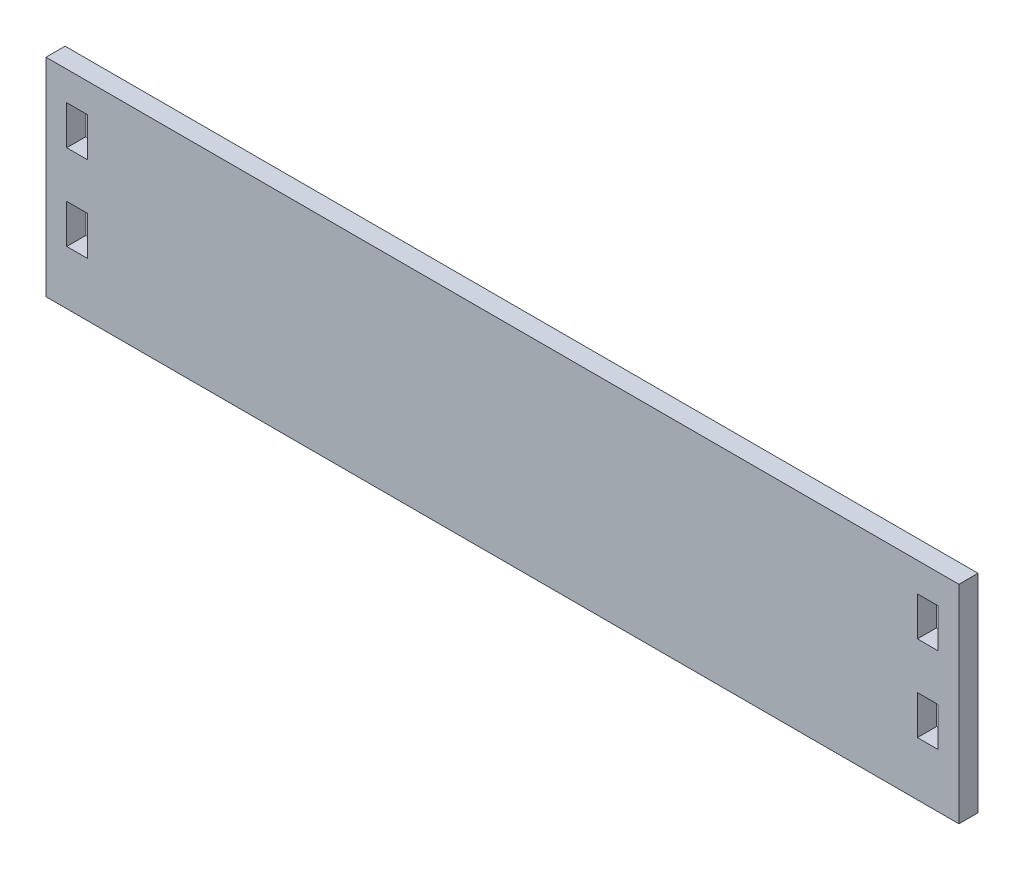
SolidWorks part; units mm, degrees
ref_plane "Front Plane" through (0, 0, 0) normal (0, 0, 1) x (1, 0, 0)
ref_plane "Top Plane" through (0, 0, 0) normal (0, 1, 0) x (1, 0, 0)
ref_plane "Right Plane" through (0, 0, 0) normal (1, 0, 0) x (0, 0, -1)
sketch "Sketch1" plane through (0, 0, 0) normal (0, 0, 1) x (1, 0, 0)
  line L0 (139.7, 63.5) -> (139.7, 0) construction
  line L1 (0, 0) -> (279.4, 0)
  line L2 (0, 0) -> (0, 63.5)
  line L3 (0, 63.5) -> (279.4, 63.5)
  line L4 (279.4, 0) -> (279.4, 63.5)
  line L5 (6.35, 28.448) -> (12.7, 28.448)
  line L6 (6.35, 28.448) -> (6.35, 16.51)
  line L7 (6.35, 16.51) -> (12.7, 16.51)
  line L8 (12.7, 28.448) -> (12.7, 16.51)
  line L9 (6.35, 54.61) -> (12.7, 54.61)
  line L10 (6.35, 54.61) -> (6.35, 42.672)
  line L11 (6.35, 42.672) -> (12.7, 42.672)
  line L12 (12.7, 54.61) -> (12.7, 42.672)
  line L13 (266.7, 54.61) -> (266.7, 42.672)
  line L14 (273.05, 42.672) -> (266.7, 42.672)
  line L15 (273.05, 54.61) -> (273.05, 42.672)
  line L16 (273.05, 54.61) -> (266.7, 54.61)
  line L17 (266.7, 28.448) -> (266.7, 16.51)
  line L18 (273.05, 16.51) -> (266.7, 16.51)
  line L19 (273.05, 28.448) -> (273.05, 16.51)
  line L20 (273.05, 28.448) -> (266.7, 28.448)
  point P13 (6.35, 22.479)
  dimension "D1" = 63.5
  dimension "D2" = 279.4
  dimension "D3" = 16.51
  dimension "D4" = 11.938
  dimension "D5" = 11.938
  dimension "D6" = 14.224
  dimension "D7" = 6.35
  dimension "D8" = 6.35
extrude "Boss-Extrude1" add sketch "Sketch1" along normal blind 5.842
